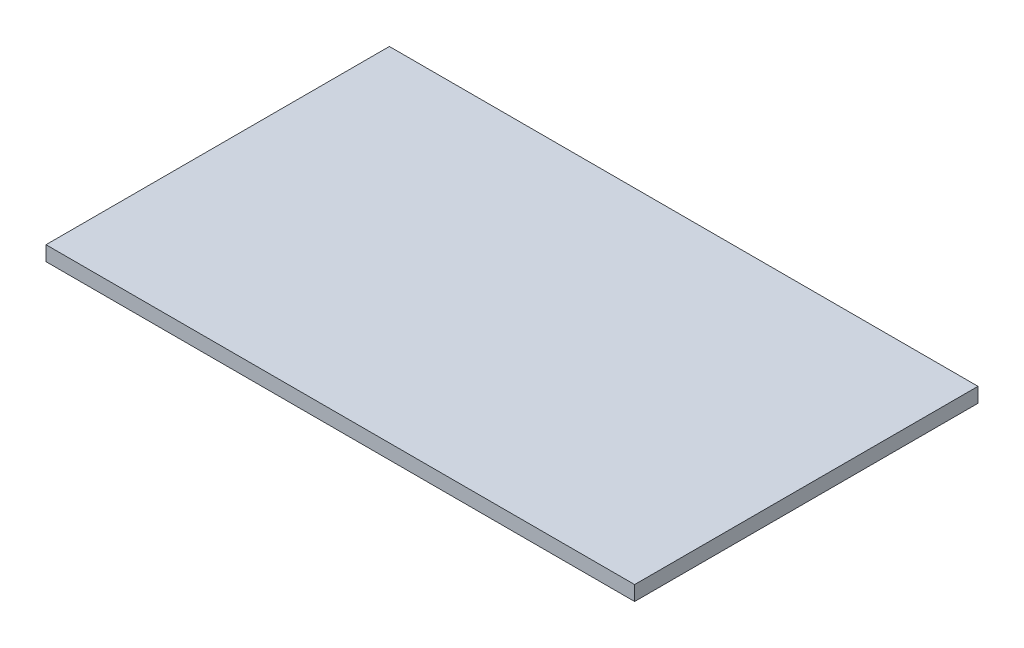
SolidWorks part; units mm, degrees
ref_plane "Plan de face" through (0, 0, 0) normal (0, 0, 1) x (1, 0, 0)
ref_plane "Plan de dessus" through (0, 0, 0) normal (0, 1, 0) x (1, 0, 0)
ref_plane "Plan de droite" through (0, 0, 0) normal (1, 0, 0) x (0, 0, -1)
sketch "Esquisse1" plane through (0, 0, 0) normal (0, 1, 0) x (1, 0, 0)
  line L1 (0, 0) -> (1200, 0)
  line L2 (0, 0) -> (0, 700)
  line L3 (0, 700) -> (1200, 700)
  line L4 (1200, 0) -> (1200, 700)
  dimension "D1" = 1200
  dimension "D2" = 700
extrude "Extrusion1" add sketch "Esquisse1" along normal blind 30
